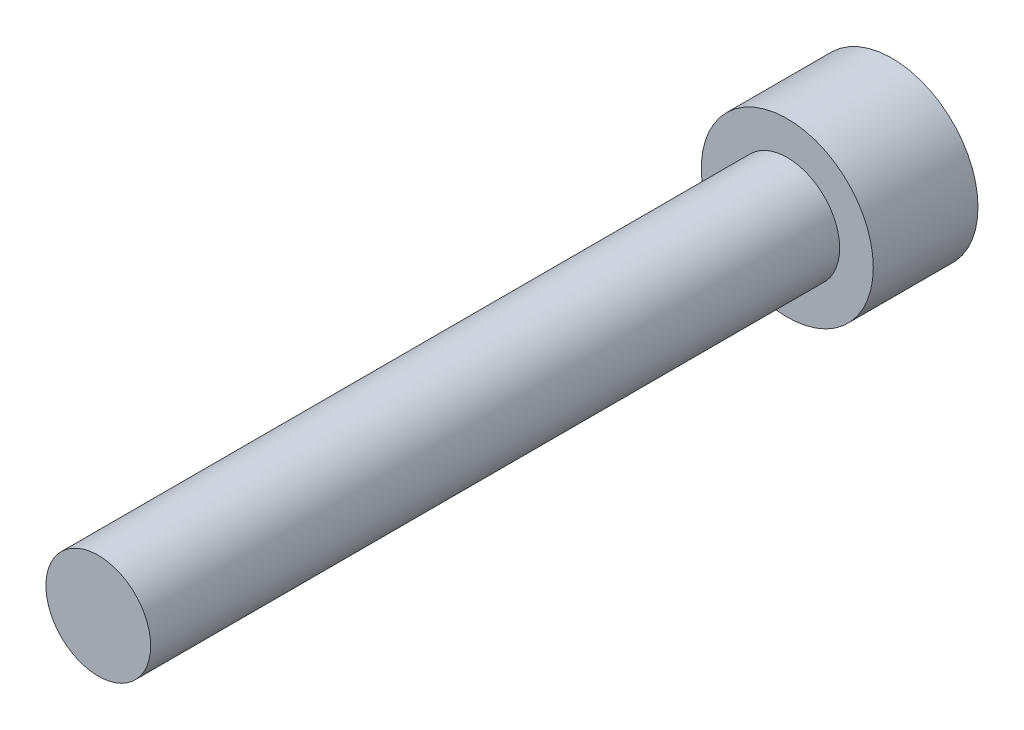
SolidWorks part; units mm, degrees
ref_plane "Front Plane" through (0, 0, 0) normal (0, 0, 1) x (1, 0, 0)
ref_plane "Top Plane" through (0, 0, 0) normal (0, 1, 0) x (1, 0, 0)
ref_plane "Right Plane" through (0, 0, 0) normal (1, 0, 0) x (0, 0, -1)
sketch "Sketch6" plane through (0, 0, 0) normal (1, 0, 0) x (0, 0, -1)
  line L0 (-31.75, 0) -> (22.525, 0) construction
  line L1 (4.3586, 0) -> (-4.3586, 0) construction
  line L2 (-31.75, 0) -> (-31.75, -2.413)
  line L3 (-31.75, -2.413) -> (0, -2.413)
  line L4 (0, 4.3586) -> (0, -4.3586) construction
  line L5 (0, -2.413) -> (0, -3.9624)
  line L6 (0, -3.9624) -> (4.826, -3.9624)
  line L7 (4.826, -3.9624) -> (4.826, 0)
  line L8 (4.826, 0) -> (-31.75, 0)
  dimension "L" = 31.75
  dimension "H" = 4.826
  dimension "A" = 7.9248
  dimension "D" = 4.826
revolve "Revolve1" add sketch "Sketch6" angle 360 about L0
sketch "Sketch7" plane through (0, 0, -4.826) normal (0, 0, -1) x (-1, 0, 0)
  line L2 (-1.9812, 1.1438) -> (-1.9812, -1.1438)
  line L4 (-1.9812, -1.1438) -> (0, -2.2877)
  line L5 (0, -2.2877) -> (1.9812, -1.1438)
  line L6 (1.9812, -1.1438) -> (1.9812, 1.1438)
  line L7 (1.9812, 1.1438) -> (0, 2.2877)
  line L8 (0, 2.2877) -> (-1.9812, 1.1438)
  circle A0 centre (0, 0) radius 1.9812 construction
  dimension "J" = 3.9624
extrude "HEX" cut sketch "Sketch7" against normal blind 3.048
